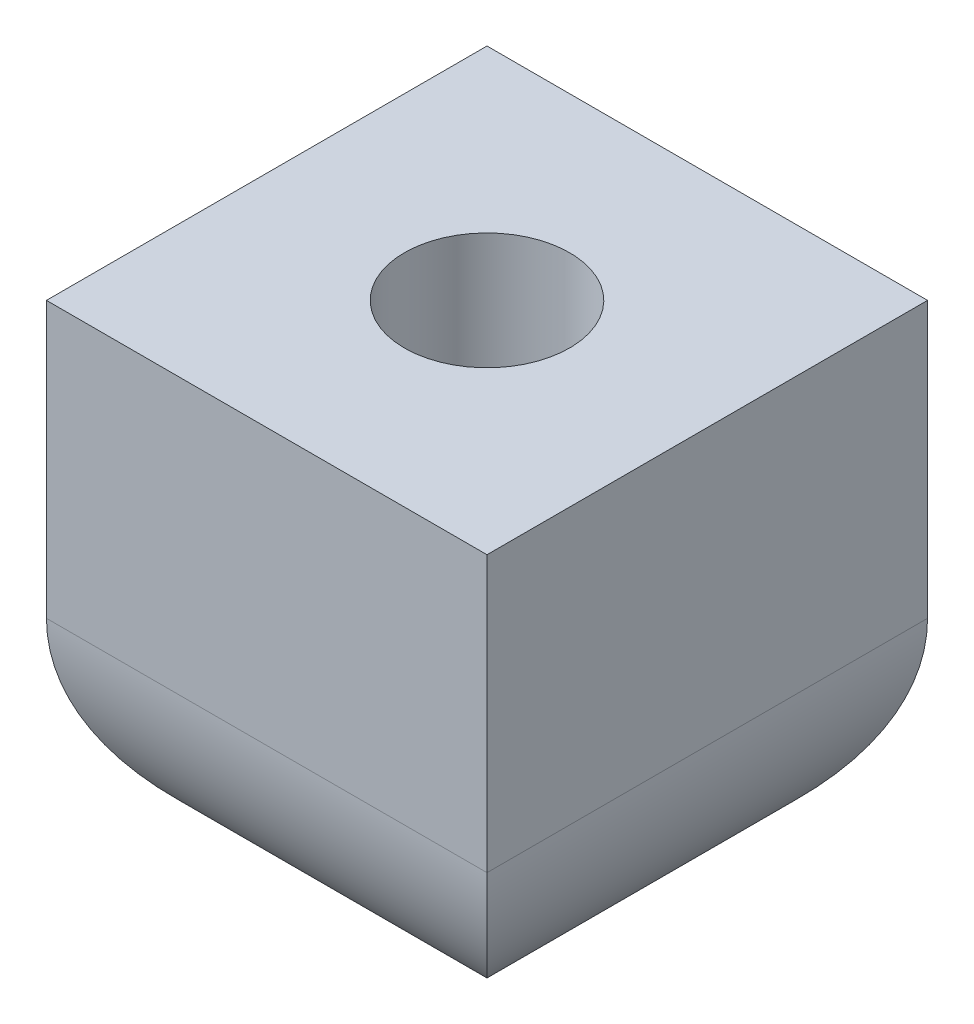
SolidWorks part; units mm, degrees
ref_plane "Front Plane" through (0, 0, 0) normal (0, 0, 1) x (1, 0, 0)
ref_plane "Top Plane" through (0, 0, 0) normal (0, 1, 0) x (1, 0, 0)
ref_plane "Right Plane" through (0, 0, 0) normal (1, 0, 0) x (0, 0, -1)
sketch "Sketch1" plane through (0, 0, 0) normal (0, 1, 0) x (1, 0, 0)
  line L1 (-4, -4) -> (4, -4)
  line L2 (-4, -4) -> (-4, 4)
  line L3 (-4, 4) -> (4, 4)
  line L4 (4, -4) -> (4, 4)
  line L5 (-4, -4) -> (4, 4) construction
  line L6 (-4, 4) -> (4, -4) construction
  point P0 (0, 0)
  dimension "D1" = 8
  dimension "D2" = 8
extrude "Boss-Extrude1" add sketch "Sketch1" along normal mid plane 9 contours L2 L3 L4 L1
fillet "Fillet1" radius 4 4 edges at (-4, -4.5, 0) (0, -4.5, -4) (4, -4.5, 0) (0, -4.5, 4)
sketch "Sketch2" plane through (0, 4.5, 0) normal (0, 1, 0) x (1, 0, 0)
  circle A0 centre (0, 0) radius 1.5
  dimension "D1" = 3
extrude "Cut-Extrude1" cut sketch "Sketch2" against normal blind 4
